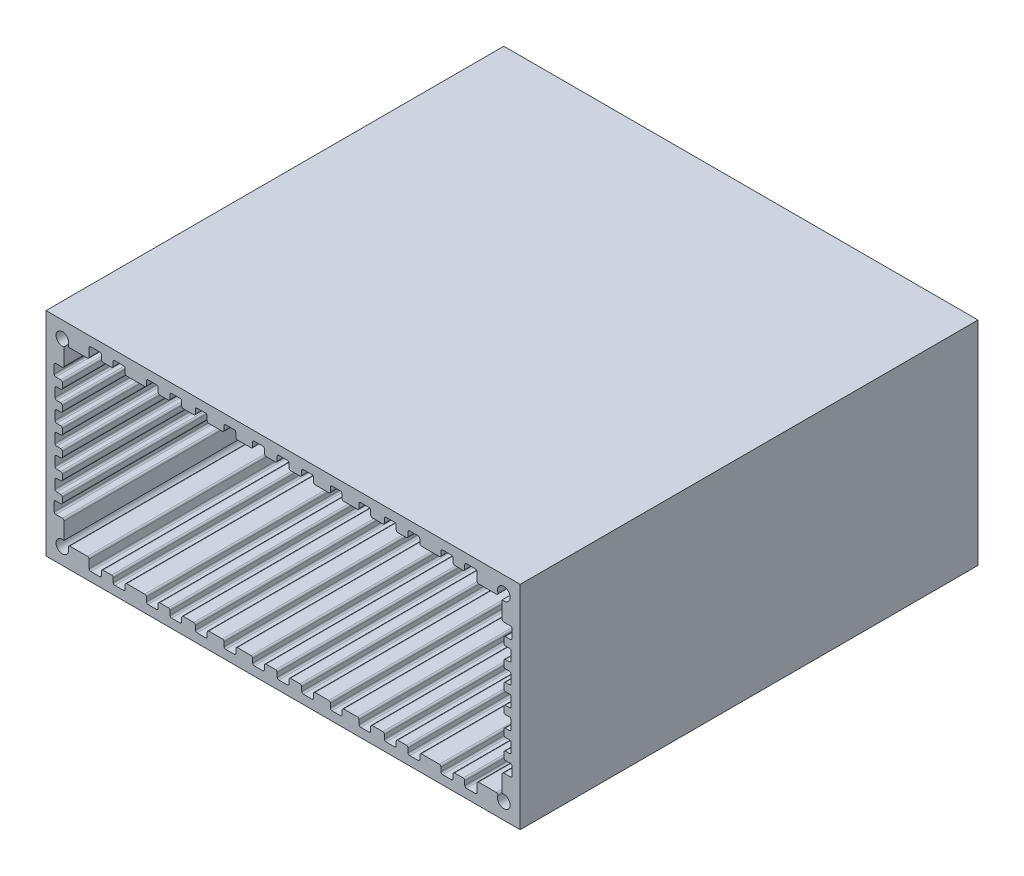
SolidWorks part; units mm, degrees
ref_plane "Front Plane" through (0, 0, 0) normal (0, 0, 1) x (1, 0, 0)
ref_plane "Top Plane" through (0, 0, 0) normal (0, 1, 0) x (1, 0, 0)
ref_plane "Right Plane" through (0, 0, 0) normal (1, 0, 0) x (0, 0, -1)
ref_plane "Plane1" through (0, 0, 0) normal (0, 0, -1) x (-1, 0, 0)
sketch "Sketch1" plane through (0, 0, 0) normal (0, 0, -1) x (-1, 0, 0)
  line L0 (-145.4685, 86.715) -> (-142.7284, 86.715)
  line L1 (-142.4744, 86.969) -> (-142.4744, 88.239)
  line L2 (-142.2204, 88.493) -> (-140.8234, 88.493)
  line L3 (-140.5694, 88.239) -> (-140.5694, 87.604)
  line L4 (-140.3154, 87.35) -> (-138.9946, 87.35)
  line L5 (-138.7406, 87.604) -> (-138.7406, 88.239)
  line L6 (-138.4866, 88.493) -> (-137.1404, 88.493)
  line L7 (-136.8864, 88.239) -> (-136.8864, 87.604)
  line L8 (-136.6324, 87.35) -> (-133.8384, 87.35)
  line L9 (-133.5844, 87.604) -> (-133.5844, 88.239)
  line L10 (-133.3304, 88.493) -> (-132.0096, 88.493)
  line L11 (-131.7556, 88.239) -> (-131.7556, 87.604)
  line L12 (-131.5016, 87.35) -> (-130.1808, 87.35)
  line L13 (-129.9268, 87.604) -> (-129.9268, 88.239)
  line L14 (-129.6728, 88.493) -> (-128.352, 88.493)
  line L15 (-128.098, 88.239) -> (-128.098, 87.604)
  line L16 (-127.844, 87.35) -> (-126.2184, 87.35)
  line L17 (-125.9644, 87.604) -> (-125.9644, 88.239)
  line L18 (-125.7104, 88.493) -> (-124.3896, 88.493)
  line L19 (-124.1356, 88.239) -> (-124.1356, 87.604)
  line L20 (-123.8816, 87.35) -> (-121.7734, 87.35)
  line L21 (-121.5194, 87.604) -> (-121.5194, 88.239)
  line L22 (-121.2654, 88.493) -> (-119.9446, 88.493)
  line L23 (-119.6906, 88.239) -> (-119.6906, 87.604)
  line L24 (-119.4366, 87.35) -> (-117.3284, 87.35)
  line L25 (-117.0744, 87.604) -> (-117.0744, 88.239)
  line L26 (-116.8204, 88.493) -> (-115.4996, 88.493)
  line L27 (-115.2456, 88.239) -> (-115.2456, 87.604)
  line L28 (-114.9916, 87.35) -> (-113.5184, 87.35)
  line L29 (-113.2644, 87.604) -> (-113.2644, 88.239)
  line L30 (-113.0104, 88.493) -> (-111.6896, 88.493)
  line L31 (-111.4356, 88.239) -> (-111.4356, 87.604)
  line L32 (-111.1816, 87.35) -> (-109.7084, 87.35)
  line L33 (-109.4544, 87.604) -> (-109.4544, 88.239)
  line L34 (-109.2004, 88.493) -> (-107.8796, 88.493)
  line L35 (-107.6256, 88.239) -> (-107.6256, 87.604)
  line L36 (-107.3716, 87.35) -> (-105.2634, 87.35)
  line L37 (-105.0094, 87.604) -> (-105.0094, 88.239)
  line L38 (-104.7554, 88.493) -> (-103.4346, 88.493)
  line L39 (-103.1806, 88.239) -> (-103.1806, 87.604)
  line L40 (-102.9266, 87.35) -> (-100.8184, 87.35)
  line L41 (-100.5644, 87.604) -> (-100.5644, 88.239)
  line L42 (-100.3104, 88.493) -> (-98.9896, 88.493)
  line L43 (-98.7356, 88.239) -> (-98.7356, 87.604)
  line L44 (-98.4816, 87.35) -> (-96.856, 87.35)
  line L45 (-96.602, 87.604) -> (-96.602, 88.239)
  line L46 (-96.348, 88.493) -> (-95.0272, 88.493)
  line L47 (-94.7732, 88.239) -> (-94.7732, 87.604)
  line L48 (-94.5192, 87.35) -> (-93.1984, 87.35)
  line L49 (-92.9444, 87.604) -> (-92.9444, 88.239)
  line L50 (-92.6904, 88.493) -> (-91.3696, 88.493)
  line L51 (-91.1156, 88.239) -> (-91.1156, 87.604)
  line L52 (-90.8616, 87.35) -> (-88.0676, 87.35)
  line L53 (-87.8136, 87.604) -> (-87.8136, 88.239)
  line L54 (-87.5596, 88.493) -> (-86.2134, 88.493)
  line L55 (-85.9594, 88.239) -> (-85.9594, 87.604)
  line L56 (-85.7054, 87.35) -> (-84.3846, 87.35)
  line L57 (-84.1306, 87.604) -> (-84.1306, 88.239)
  line L58 (-83.8766, 88.493) -> (-82.4796, 88.493)
  line L59 (-82.2256, 88.239) -> (-82.2256, 86.969)
  line L60 (-81.9716, 86.715) -> (-79.2315, 86.715)
  line L61 (-78.314, 86.4057) -> (-78.314, 83.794)
  line L62 (-78.06, 83.54) -> (-77.044, 83.54)
  line L63 (-76.79, 83.286) -> (-76.79, 81.9652)
  line L64 (-77.044, 81.7112) -> (-77.806, 81.7112)
  line L65 (-78.06, 81.4572) -> (-78.06, 80.7104)
  line L66 (-77.806, 80.4564) -> (-77.171, 80.4564)
  line L67 (-76.917, 80.2024) -> (-76.917, 78.8816)
  line L68 (-77.171, 78.6276) -> (-77.806, 78.6276)
  line L69 (-78.06, 78.3736) -> (-78.06, 77.6294)
  line L70 (-77.806, 77.3754) -> (-77.171, 77.3754)
  line L71 (-76.917, 77.1214) -> (-76.917, 75.8006)
  line L72 (-77.171, 75.5466) -> (-77.806, 75.5466)
  line L73 (-78.06, 75.2926) -> (-78.06, 74.5484)
  line L74 (-77.806, 74.2944) -> (-77.171, 74.2944)
  line L75 (-76.917, 74.0404) -> (-76.917, 72.7196)
  line L76 (-77.171, 72.4656) -> (-77.806, 72.4656)
  line L77 (-78.06, 72.2116) -> (-78.06, 71.4674)
  line L78 (-77.806, 71.2134) -> (-77.171, 71.2134)
  line L79 (-76.917, 70.9594) -> (-76.917, 69.6386)
  line L80 (-77.171, 69.3846) -> (-77.806, 69.3846)
  line L81 (-78.06, 69.1306) -> (-78.06, 68.3864)
  line L82 (-77.806, 68.1324) -> (-77.171, 68.1324)
  line L83 (-76.917, 67.8784) -> (-76.917, 66.5576)
  line L84 (-77.171, 66.3036) -> (-77.806, 66.3036)
  line L85 (-78.06, 66.0496) -> (-78.06, 65.3028)
  line L86 (-77.806, 65.0488) -> (-77.044, 65.0488)
  line L87 (-76.79, 64.7948) -> (-76.79, 63.474)
  line L88 (-77.044, 63.22) -> (-78.06, 63.22)
  line L89 (-78.314, 62.966) -> (-78.314, 60.3543)
  line L90 (-79.2315, 60.045) -> (-81.9716, 60.045)
  line L91 (-82.2256, 59.791) -> (-82.2256, 58.521)
  line L92 (-82.4796, 58.267) -> (-83.8766, 58.267)
  line L93 (-84.1306, 58.521) -> (-84.1306, 59.156)
  line L94 (-84.3846, 59.41) -> (-85.7054, 59.41)
  line L95 (-85.9594, 59.156) -> (-85.9594, 58.521)
  line L96 (-86.2134, 58.267) -> (-87.5596, 58.267)
  line L97 (-87.8136, 58.521) -> (-87.8136, 59.156)
  line L98 (-88.0676, 59.41) -> (-90.8616, 59.41)
  line L99 (-91.1156, 59.156) -> (-91.1156, 58.521)
  line L100 (-91.3696, 58.267) -> (-92.6904, 58.267)
  line L101 (-92.9444, 58.521) -> (-92.9444, 59.156)
  line L102 (-93.1984, 59.41) -> (-94.5192, 59.41)
  line L103 (-94.7732, 59.156) -> (-94.7732, 58.521)
  line L104 (-95.0272, 58.267) -> (-96.348, 58.267)
  line L105 (-96.602, 58.521) -> (-96.602, 59.156)
  line L106 (-96.856, 59.41) -> (-98.4816, 59.41)
  line L107 (-98.7356, 59.156) -> (-98.7356, 58.521)
  line L108 (-98.9896, 58.267) -> (-100.3104, 58.267)
  line L109 (-100.5644, 58.521) -> (-100.5644, 59.156)
  line L110 (-100.8184, 59.41) -> (-102.9266, 59.41)
  line L111 (-103.1806, 59.156) -> (-103.1806, 58.521)
  line L112 (-103.4346, 58.267) -> (-104.7554, 58.267)
  line L113 (-105.0094, 58.521) -> (-105.0094, 59.156)
  line L114 (-105.2634, 59.41) -> (-107.3716, 59.41)
  line L115 (-107.6256, 59.156) -> (-107.6256, 58.521)
  line L116 (-107.8796, 58.267) -> (-109.2004, 58.267)
  line L117 (-109.4544, 58.521) -> (-109.4544, 59.156)
  line L118 (-109.7084, 59.41) -> (-111.1816, 59.41)
  line L119 (-111.4356, 59.156) -> (-111.4356, 58.521)
  line L120 (-111.6896, 58.267) -> (-113.0104, 58.267)
  line L121 (-113.2644, 58.521) -> (-113.2644, 59.156)
  line L122 (-113.5184, 59.41) -> (-114.9916, 59.41)
  line L123 (-115.2456, 59.156) -> (-115.2456, 58.521)
  line L124 (-115.4996, 58.267) -> (-116.8204, 58.267)
  line L125 (-117.0744, 58.521) -> (-117.0744, 59.156)
  line L126 (-117.3284, 59.41) -> (-119.4366, 59.41)
  line L127 (-119.6906, 59.156) -> (-119.6906, 58.521)
  line L128 (-119.9446, 58.267) -> (-121.2654, 58.267)
  line L129 (-121.5194, 58.521) -> (-121.5194, 59.156)
  line L130 (-121.7734, 59.41) -> (-123.8816, 59.41)
  line L131 (-124.1356, 59.156) -> (-124.1356, 58.521)
  line L132 (-124.3896, 58.267) -> (-125.7104, 58.267)
  line L133 (-125.9644, 58.521) -> (-125.9644, 59.156)
  line L134 (-126.2184, 59.41) -> (-127.844, 59.41)
  line L135 (-128.098, 59.156) -> (-128.098, 58.521)
  line L136 (-128.352, 58.267) -> (-129.6728, 58.267)
  line L137 (-129.9268, 58.521) -> (-129.9268, 59.156)
  line L138 (-130.1808, 59.41) -> (-131.5016, 59.41)
  line L139 (-131.7556, 59.156) -> (-131.7556, 58.521)
  line L140 (-132.0096, 58.267) -> (-133.3304, 58.267)
  line L141 (-133.5844, 58.521) -> (-133.5844, 59.156)
  line L142 (-133.8384, 59.41) -> (-136.6324, 59.41)
  line L143 (-136.8864, 59.156) -> (-136.8864, 58.521)
  line L144 (-137.1404, 58.267) -> (-138.4866, 58.267)
  line L145 (-138.7406, 58.521) -> (-138.7406, 59.156)
  line L146 (-138.9946, 59.41) -> (-140.3154, 59.41)
  line L147 (-140.5694, 59.156) -> (-140.5694, 58.521)
  line L148 (-140.8234, 58.267) -> (-142.2204, 58.267)
  line L149 (-142.4744, 58.521) -> (-142.4744, 59.791)
  line L150 (-142.7284, 60.045) -> (-145.4685, 60.045)
  line L151 (-146.386, 60.3543) -> (-146.386, 62.966)
  line L152 (-146.64, 63.22) -> (-147.656, 63.22)
  line L153 (-147.91, 63.474) -> (-147.91, 64.7948)
  line L154 (-147.656, 65.0488) -> (-146.894, 65.0488)
  line L155 (-146.64, 65.3028) -> (-146.64, 66.0496)
  line L156 (-146.894, 66.3036) -> (-147.529, 66.3036)
  line L157 (-147.783, 66.5576) -> (-147.783, 67.8784)
  line L158 (-147.529, 68.1324) -> (-146.894, 68.1324)
  line L159 (-146.64, 68.3864) -> (-146.64, 69.1306)
  line L160 (-146.894, 69.3846) -> (-147.529, 69.3846)
  line L161 (-147.783, 69.6386) -> (-147.783, 70.9594)
  line L162 (-147.529, 71.2134) -> (-146.894, 71.2134)
  line L163 (-146.64, 71.4674) -> (-146.64, 72.2116)
  line L164 (-146.894, 72.4656) -> (-147.529, 72.4656)
  line L165 (-147.783, 72.7196) -> (-147.783, 74.0404)
  line L166 (-147.529, 74.2944) -> (-146.894, 74.2944)
  line L167 (-146.64, 74.5484) -> (-146.64, 75.2926)
  line L168 (-146.894, 75.5466) -> (-147.529, 75.5466)
  line L169 (-147.783, 75.8006) -> (-147.783, 77.1214)
  line L170 (-147.529, 77.3754) -> (-146.894, 77.3754)
  line L171 (-146.64, 77.6294) -> (-146.64, 78.3736)
  line L172 (-146.894, 78.6276) -> (-147.529, 78.6276)
  line L173 (-147.783, 78.8816) -> (-147.783, 80.2024)
  line L174 (-147.529, 80.4564) -> (-146.894, 80.4564)
  line L175 (-146.64, 80.7104) -> (-146.64, 81.4572)
  line L176 (-146.894, 81.7112) -> (-147.656, 81.7112)
  line L177 (-147.91, 81.9652) -> (-147.91, 83.286)
  line L178 (-147.656, 83.54) -> (-146.64, 83.54)
  line L179 (-146.386, 83.794) -> (-146.386, 86.4057)
  line L180 (-75.52, 89.89) -> (-149.18, 89.89)
  line L181 (-149.18, 89.89) -> (-149.18, 56.87)
  line L182 (-149.18, 56.87) -> (-75.52, 56.87)
  line L183 (-75.52, 56.87) -> (-75.52, 89.89)
  arc A0 (-142.7284, 86.715) -> (-142.4744, 86.969) centre (-142.7284, 86.969) ccw
  arc A1 (-142.4744, 88.239) -> (-142.2204, 88.493) centre (-142.2204, 88.239) cw
  arc A2 (-140.8234, 88.493) -> (-140.5694, 88.239) centre (-140.8234, 88.239) cw
  arc A3 (-140.5694, 87.604) -> (-140.3154, 87.35) centre (-140.3154, 87.604) ccw
  arc A4 (-138.9946, 87.35) -> (-138.7406, 87.604) centre (-138.9946, 87.604) ccw
  arc A5 (-138.7406, 88.239) -> (-138.4866, 88.493) centre (-138.4866, 88.239) cw
  arc A6 (-137.1404, 88.493) -> (-136.8864, 88.239) centre (-137.1404, 88.239) cw
  arc A7 (-136.8864, 87.604) -> (-136.6324, 87.35) centre (-136.6324, 87.604) ccw
  arc A8 (-133.8384, 87.35) -> (-133.5844, 87.604) centre (-133.8384, 87.604) ccw
  arc A9 (-133.5844, 88.239) -> (-133.3304, 88.493) centre (-133.3304, 88.239) cw
  arc A10 (-132.0096, 88.493) -> (-131.7556, 88.239) centre (-132.0096, 88.239) cw
  arc A11 (-131.7556, 87.604) -> (-131.5016, 87.35) centre (-131.5016, 87.604) ccw
  arc A12 (-130.1808, 87.35) -> (-129.9268, 87.604) centre (-130.1808, 87.604) ccw
  arc A13 (-129.9268, 88.239) -> (-129.6728, 88.493) centre (-129.6728, 88.239) cw
  arc A14 (-128.352, 88.493) -> (-128.098, 88.239) centre (-128.352, 88.239) cw
  arc A15 (-128.098, 87.604) -> (-127.844, 87.35) centre (-127.844, 87.604) ccw
  arc A16 (-126.2184, 87.35) -> (-125.9644, 87.604) centre (-126.2184, 87.604) ccw
  arc A17 (-125.9644, 88.239) -> (-125.7104, 88.493) centre (-125.7104, 88.239) cw
  arc A18 (-124.3896, 88.493) -> (-124.1356, 88.239) centre (-124.3896, 88.239) cw
  arc A19 (-124.1356, 87.604) -> (-123.8816, 87.35) centre (-123.8816, 87.604) ccw
  arc A20 (-121.7734, 87.35) -> (-121.5194, 87.604) centre (-121.7734, 87.604) ccw
  arc A21 (-121.5194, 88.239) -> (-121.2654, 88.493) centre (-121.2654, 88.239) cw
  arc A22 (-119.9446, 88.493) -> (-119.6906, 88.239) centre (-119.9446, 88.239) cw
  arc A23 (-119.6906, 87.604) -> (-119.4366, 87.35) centre (-119.4366, 87.604) ccw
  arc A24 (-117.3284, 87.35) -> (-117.0744, 87.604) centre (-117.3284, 87.604) ccw
  arc A25 (-117.0744, 88.239) -> (-116.8204, 88.493) centre (-116.8204, 88.239) cw
  arc A26 (-115.4996, 88.493) -> (-115.2456, 88.239) centre (-115.4996, 88.239) cw
  arc A27 (-115.2456, 87.604) -> (-114.9916, 87.35) centre (-114.9916, 87.604) ccw
  arc A28 (-113.5184, 87.35) -> (-113.2644, 87.604) centre (-113.5184, 87.604) ccw
  arc A29 (-113.2644, 88.239) -> (-113.0104, 88.493) centre (-113.0104, 88.239) cw
  arc A30 (-111.6896, 88.493) -> (-111.4356, 88.239) centre (-111.6896, 88.239) cw
  arc A31 (-111.4356, 87.604) -> (-111.1816, 87.35) centre (-111.1816, 87.604) ccw
  arc A32 (-109.7084, 87.35) -> (-109.4544, 87.604) centre (-109.7084, 87.604) ccw
  arc A33 (-109.4544, 88.239) -> (-109.2004, 88.493) centre (-109.2004, 88.239) cw
  arc A34 (-107.8796, 88.493) -> (-107.6256, 88.239) centre (-107.8796, 88.239) cw
  arc A35 (-107.6256, 87.604) -> (-107.3716, 87.35) centre (-107.3716, 87.604) ccw
  arc A36 (-105.2634, 87.35) -> (-105.0094, 87.604) centre (-105.2634, 87.604) ccw
  arc A37 (-105.0094, 88.239) -> (-104.7554, 88.493) centre (-104.7554, 88.239) cw
  arc A38 (-103.4346, 88.493) -> (-103.1806, 88.239) centre (-103.4346, 88.239) cw
  arc A39 (-103.1806, 87.604) -> (-102.9266, 87.35) centre (-102.9266, 87.604) ccw
  arc A40 (-100.8184, 87.35) -> (-100.5644, 87.604) centre (-100.8184, 87.604) ccw
  arc A41 (-100.5644, 88.239) -> (-100.3104, 88.493) centre (-100.3104, 88.239) cw
  arc A42 (-98.9896, 88.493) -> (-98.7356, 88.239) centre (-98.9896, 88.239) cw
  arc A43 (-98.7356, 87.604) -> (-98.4816, 87.35) centre (-98.4816, 87.604) ccw
  arc A44 (-96.856, 87.35) -> (-96.602, 87.604) centre (-96.856, 87.604) ccw
  arc A45 (-96.602, 88.239) -> (-96.348, 88.493) centre (-96.348, 88.239) cw
  arc A46 (-95.0272, 88.493) -> (-94.7732, 88.239) centre (-95.0272, 88.239) cw
  arc A47 (-94.7732, 87.604) -> (-94.5192, 87.35) centre (-94.5192, 87.604) ccw
  arc A48 (-93.1984, 87.35) -> (-92.9444, 87.604) centre (-93.1984, 87.604) ccw
  arc A49 (-92.9444, 88.239) -> (-92.6904, 88.493) centre (-92.6904, 88.239) cw
  arc A50 (-91.3696, 88.493) -> (-91.1156, 88.239) centre (-91.3696, 88.239) cw
  arc A51 (-91.1156, 87.604) -> (-90.8616, 87.35) centre (-90.8616, 87.604) ccw
  arc A52 (-88.0676, 87.35) -> (-87.8136, 87.604) centre (-88.0676, 87.604) ccw
  arc A53 (-87.8136, 88.239) -> (-87.5596, 88.493) centre (-87.5596, 88.239) cw
  arc A54 (-86.2134, 88.493) -> (-85.9594, 88.239) centre (-86.2134, 88.239) cw
  arc A55 (-85.9594, 87.604) -> (-85.7054, 87.35) centre (-85.7054, 87.604) ccw
  arc A56 (-84.3846, 87.35) -> (-84.1306, 87.604) centre (-84.3846, 87.604) ccw
  arc A57 (-84.1306, 88.239) -> (-83.8766, 88.493) centre (-83.8766, 88.239) cw
  arc A58 (-82.4796, 88.493) -> (-82.2256, 88.239) centre (-82.4796, 88.239) cw
  arc A59 (-82.2256, 86.969) -> (-81.9716, 86.715) centre (-81.9716, 86.969) ccw
  arc A60 (-79.2315, 86.715) -> (-78.99, 87.0476) centre (-79.2315, 86.969) ccw
  arc A61 (-78.99, 87.0476) -> (-78.314, 86.4057) centre (-78.06, 87.35) cw
  arc A62 (-78.314, 83.794) -> (-78.06, 83.54) centre (-78.06, 83.794) ccw
  arc A63 (-77.044, 83.54) -> (-76.79, 83.286) centre (-77.044, 83.286) cw
  arc A64 (-76.79, 81.9652) -> (-77.044, 81.7112) centre (-77.044, 81.9652) cw
  arc A65 (-77.806, 81.7112) -> (-78.06, 81.4572) centre (-77.806, 81.4572) ccw
  arc A66 (-78.06, 80.7104) -> (-77.806, 80.4564) centre (-77.806, 80.7104) ccw
  arc A67 (-77.171, 80.4564) -> (-76.917, 80.2024) centre (-77.171, 80.2024) cw
  arc A68 (-76.917, 78.8816) -> (-77.171, 78.6276) centre (-77.171, 78.8816) cw
  arc A69 (-77.806, 78.6276) -> (-78.06, 78.3736) centre (-77.806, 78.3736) ccw
  arc A70 (-78.06, 77.6294) -> (-77.806, 77.3754) centre (-77.806, 77.6294) ccw
  arc A71 (-77.171, 77.3754) -> (-76.917, 77.1214) centre (-77.171, 77.1214) cw
  arc A72 (-76.917, 75.8006) -> (-77.171, 75.5466) centre (-77.171, 75.8006) cw
  arc A73 (-77.806, 75.5466) -> (-78.06, 75.2926) centre (-77.806, 75.2926) ccw
  arc A74 (-78.06, 74.5484) -> (-77.806, 74.2944) centre (-77.806, 74.5484) ccw
  arc A75 (-77.171, 74.2944) -> (-76.917, 74.0404) centre (-77.171, 74.0404) cw
  arc A76 (-76.917, 72.7196) -> (-77.171, 72.4656) centre (-77.171, 72.7196) cw
  arc A77 (-77.806, 72.4656) -> (-78.06, 72.2116) centre (-77.806, 72.2116) ccw
  arc A78 (-78.06, 71.4674) -> (-77.806, 71.2134) centre (-77.806, 71.4674) ccw
  arc A79 (-77.171, 71.2134) -> (-76.917, 70.9594) centre (-77.171, 70.9594) cw
  arc A80 (-76.917, 69.6386) -> (-77.171, 69.3846) centre (-77.171, 69.6386) cw
  arc A81 (-77.806, 69.3846) -> (-78.06, 69.1306) centre (-77.806, 69.1306) ccw
  arc A82 (-78.06, 68.3864) -> (-77.806, 68.1324) centre (-77.806, 68.3864) ccw
  arc A83 (-77.171, 68.1324) -> (-76.917, 67.8784) centre (-77.171, 67.8784) cw
  arc A84 (-76.917, 66.5576) -> (-77.171, 66.3036) centre (-77.171, 66.5576) cw
  arc A85 (-77.806, 66.3036) -> (-78.06, 66.0496) centre (-77.806, 66.0496) ccw
  arc A86 (-78.06, 65.3028) -> (-77.806, 65.0488) centre (-77.806, 65.3028) ccw
  arc A87 (-77.044, 65.0488) -> (-76.79, 64.7948) centre (-77.044, 64.7948) cw
  arc A88 (-76.79, 63.474) -> (-77.044, 63.22) centre (-77.044, 63.474) cw
  arc A89 (-78.06, 63.22) -> (-78.314, 62.966) centre (-78.06, 62.966) ccw
  arc A90 (-78.314, 60.3543) -> (-78.99, 59.7124) centre (-78.06, 59.41) cw
  arc A91 (-78.99, 59.7124) -> (-79.2315, 60.045) centre (-79.2315, 59.791) ccw
  arc A92 (-81.9716, 60.045) -> (-82.2256, 59.791) centre (-81.9716, 59.791) ccw
  arc A93 (-82.2256, 58.521) -> (-82.4796, 58.267) centre (-82.4796, 58.521) cw
  arc A94 (-83.8766, 58.267) -> (-84.1306, 58.521) centre (-83.8766, 58.521) cw
  arc A95 (-84.1306, 59.156) -> (-84.3846, 59.41) centre (-84.3846, 59.156) ccw
  arc A96 (-85.7054, 59.41) -> (-85.9594, 59.156) centre (-85.7054, 59.156) ccw
  arc A97 (-85.9594, 58.521) -> (-86.2134, 58.267) centre (-86.2134, 58.521) cw
  arc A98 (-87.5596, 58.267) -> (-87.8136, 58.521) centre (-87.5596, 58.521) cw
  arc A99 (-87.8136, 59.156) -> (-88.0676, 59.41) centre (-88.0676, 59.156) ccw
  arc A100 (-90.8616, 59.41) -> (-91.1156, 59.156) centre (-90.8616, 59.156) ccw
  arc A101 (-91.1156, 58.521) -> (-91.3696, 58.267) centre (-91.3696, 58.521) cw
  arc A102 (-92.6904, 58.267) -> (-92.9444, 58.521) centre (-92.6904, 58.521) cw
  arc A103 (-92.9444, 59.156) -> (-93.1984, 59.41) centre (-93.1984, 59.156) ccw
  arc A104 (-94.5192, 59.41) -> (-94.7732, 59.156) centre (-94.5192, 59.156) ccw
  arc A105 (-94.7732, 58.521) -> (-95.0272, 58.267) centre (-95.0272, 58.521) cw
  arc A106 (-96.348, 58.267) -> (-96.602, 58.521) centre (-96.348, 58.521) cw
  arc A107 (-96.602, 59.156) -> (-96.856, 59.41) centre (-96.856, 59.156) ccw
  arc A108 (-98.4816, 59.41) -> (-98.7356, 59.156) centre (-98.4816, 59.156) ccw
  arc A109 (-98.7356, 58.521) -> (-98.9896, 58.267) centre (-98.9896, 58.521) cw
  arc A110 (-100.3104, 58.267) -> (-100.5644, 58.521) centre (-100.3104, 58.521) cw
  arc A111 (-100.5644, 59.156) -> (-100.8184, 59.41) centre (-100.8184, 59.156) ccw
  arc A112 (-102.9266, 59.41) -> (-103.1806, 59.156) centre (-102.9266, 59.156) ccw
  arc A113 (-103.1806, 58.521) -> (-103.4346, 58.267) centre (-103.4346, 58.521) cw
  arc A114 (-104.7554, 58.267) -> (-105.0094, 58.521) centre (-104.7554, 58.521) cw
  arc A115 (-105.0094, 59.156) -> (-105.2634, 59.41) centre (-105.2634, 59.156) ccw
  arc A116 (-107.3716, 59.41) -> (-107.6256, 59.156) centre (-107.3716, 59.156) ccw
  arc A117 (-107.6256, 58.521) -> (-107.8796, 58.267) centre (-107.8796, 58.521) cw
  arc A118 (-109.2004, 58.267) -> (-109.4544, 58.521) centre (-109.2004, 58.521) cw
  arc A119 (-109.4544, 59.156) -> (-109.7084, 59.41) centre (-109.7084, 59.156) ccw
  arc A120 (-111.1816, 59.41) -> (-111.4356, 59.156) centre (-111.1816, 59.156) ccw
  arc A121 (-111.4356, 58.521) -> (-111.6896, 58.267) centre (-111.6896, 58.521) cw
  arc A122 (-113.0104, 58.267) -> (-113.2644, 58.521) centre (-113.0104, 58.521) cw
  arc A123 (-113.2644, 59.156) -> (-113.5184, 59.41) centre (-113.5184, 59.156) ccw
  arc A124 (-114.9916, 59.41) -> (-115.2456, 59.156) centre (-114.9916, 59.156) ccw
  arc A125 (-115.2456, 58.521) -> (-115.4996, 58.267) centre (-115.4996, 58.521) cw
  arc A126 (-116.8204, 58.267) -> (-117.0744, 58.521) centre (-116.8204, 58.521) cw
  arc A127 (-117.0744, 59.156) -> (-117.3284, 59.41) centre (-117.3284, 59.156) ccw
  arc A128 (-119.4366, 59.41) -> (-119.6906, 59.156) centre (-119.4366, 59.156) ccw
  arc A129 (-119.6906, 58.521) -> (-119.9446, 58.267) centre (-119.9446, 58.521) cw
  arc A130 (-121.2654, 58.267) -> (-121.5194, 58.521) centre (-121.2654, 58.521) cw
  arc A131 (-121.5194, 59.156) -> (-121.7734, 59.41) centre (-121.7734, 59.156) ccw
  arc A132 (-123.8816, 59.41) -> (-124.1356, 59.156) centre (-123.8816, 59.156) ccw
  arc A133 (-124.1356, 58.521) -> (-124.3896, 58.267) centre (-124.3896, 58.521) cw
  arc A134 (-125.7104, 58.267) -> (-125.9644, 58.521) centre (-125.7104, 58.521) cw
  arc A135 (-125.9644, 59.156) -> (-126.2184, 59.41) centre (-126.2184, 59.156) ccw
  arc A136 (-127.844, 59.41) -> (-128.098, 59.156) centre (-127.844, 59.156) ccw
  arc A137 (-128.098, 58.521) -> (-128.352, 58.267) centre (-128.352, 58.521) cw
  arc A138 (-129.6728, 58.267) -> (-129.9268, 58.521) centre (-129.6728, 58.521) cw
  arc A139 (-129.9268, 59.156) -> (-130.1808, 59.41) centre (-130.1808, 59.156) ccw
  arc A140 (-131.5016, 59.41) -> (-131.7556, 59.156) centre (-131.5016, 59.156) ccw
  arc A141 (-131.7556, 58.521) -> (-132.0096, 58.267) centre (-132.0096, 58.521) cw
  arc A142 (-133.3304, 58.267) -> (-133.5844, 58.521) centre (-133.3304, 58.521) cw
  arc A143 (-133.5844, 59.156) -> (-133.8384, 59.41) centre (-133.8384, 59.156) ccw
  arc A144 (-136.6324, 59.41) -> (-136.8864, 59.156) centre (-136.6324, 59.156) ccw
  arc A145 (-136.8864, 58.521) -> (-137.1404, 58.267) centre (-137.1404, 58.521) cw
  arc A146 (-138.4866, 58.267) -> (-138.7406, 58.521) centre (-138.4866, 58.521) cw
  arc A147 (-138.7406, 59.156) -> (-138.9946, 59.41) centre (-138.9946, 59.156) ccw
  arc A148 (-140.3154, 59.41) -> (-140.5694, 59.156) centre (-140.3154, 59.156) ccw
  arc A149 (-140.5694, 58.521) -> (-140.8234, 58.267) centre (-140.8234, 58.521) cw
  arc A150 (-142.2204, 58.267) -> (-142.4744, 58.521) centre (-142.2204, 58.521) cw
  arc A151 (-142.4744, 59.791) -> (-142.7284, 60.045) centre (-142.7284, 59.791) ccw
  arc A152 (-145.4685, 60.045) -> (-145.71, 59.7124) centre (-145.4685, 59.791) ccw
  arc A153 (-145.71, 59.7124) -> (-146.386, 60.3543) centre (-146.64, 59.41) cw
  arc A154 (-146.386, 62.966) -> (-146.64, 63.22) centre (-146.64, 62.966) ccw
  arc A155 (-147.656, 63.22) -> (-147.91, 63.474) centre (-147.656, 63.474) cw
  arc A156 (-147.91, 64.7948) -> (-147.656, 65.0488) centre (-147.656, 64.7948) cw
  arc A157 (-146.894, 65.0488) -> (-146.64, 65.3028) centre (-146.894, 65.3028) ccw
  arc A158 (-146.64, 66.0496) -> (-146.894, 66.3036) centre (-146.894, 66.0496) ccw
  arc A159 (-147.529, 66.3036) -> (-147.783, 66.5576) centre (-147.529, 66.5576) cw
  arc A160 (-147.783, 67.8784) -> (-147.529, 68.1324) centre (-147.529, 67.8784) cw
  arc A161 (-146.894, 68.1324) -> (-146.64, 68.3864) centre (-146.894, 68.3864) ccw
  arc A162 (-146.64, 69.1306) -> (-146.894, 69.3846) centre (-146.894, 69.1306) ccw
  arc A163 (-147.529, 69.3846) -> (-147.783, 69.6386) centre (-147.529, 69.6386) cw
  arc A164 (-147.783, 70.9594) -> (-147.529, 71.2134) centre (-147.529, 70.9594) cw
  arc A165 (-146.894, 71.2134) -> (-146.64, 71.4674) centre (-146.894, 71.4674) ccw
  arc A166 (-146.64, 72.2116) -> (-146.894, 72.4656) centre (-146.894, 72.2116) ccw
  arc A167 (-147.529, 72.4656) -> (-147.783, 72.7196) centre (-147.529, 72.7196) cw
  arc A168 (-147.783, 74.0404) -> (-147.529, 74.2944) centre (-147.529, 74.0404) cw
  arc A169 (-146.894, 74.2944) -> (-146.64, 74.5484) centre (-146.894, 74.5484) ccw
  arc A170 (-146.64, 75.2926) -> (-146.894, 75.5466) centre (-146.894, 75.2926) ccw
  arc A171 (-147.529, 75.5466) -> (-147.783, 75.8006) centre (-147.529, 75.8006) cw
  arc A172 (-147.783, 77.1214) -> (-147.529, 77.3754) centre (-147.529, 77.1214) cw
  arc A173 (-146.894, 77.3754) -> (-146.64, 77.6294) centre (-146.894, 77.6294) ccw
  arc A174 (-146.64, 78.3736) -> (-146.894, 78.6276) centre (-146.894, 78.3736) ccw
  arc A175 (-147.529, 78.6276) -> (-147.783, 78.8816) centre (-147.529, 78.8816) cw
  arc A176 (-147.783, 80.2024) -> (-147.529, 80.4564) centre (-147.529, 80.2024) cw
  arc A177 (-146.894, 80.4564) -> (-146.64, 80.7104) centre (-146.894, 80.7104) ccw
  arc A178 (-146.64, 81.4572) -> (-146.894, 81.7112) centre (-146.894, 81.4572) ccw
  arc A179 (-147.656, 81.7112) -> (-147.91, 81.9652) centre (-147.656, 81.9652) cw
  arc A180 (-147.91, 83.286) -> (-147.656, 83.54) centre (-147.656, 83.286) cw
  arc A181 (-146.64, 83.54) -> (-146.386, 83.794) centre (-146.64, 83.794) ccw
  arc A182 (-146.386, 86.4057) -> (-145.71, 87.0476) centre (-146.64, 87.35) cw
  arc A183 (-145.71, 87.0476) -> (-145.4685, 86.715) centre (-145.4685, 86.969) ccw
  dimension "D1" = 33.02
  dimension "D2" = 73.66
extrude "Boss-Extrude1" add sketch "Sketch1" against normal blind 71.12
